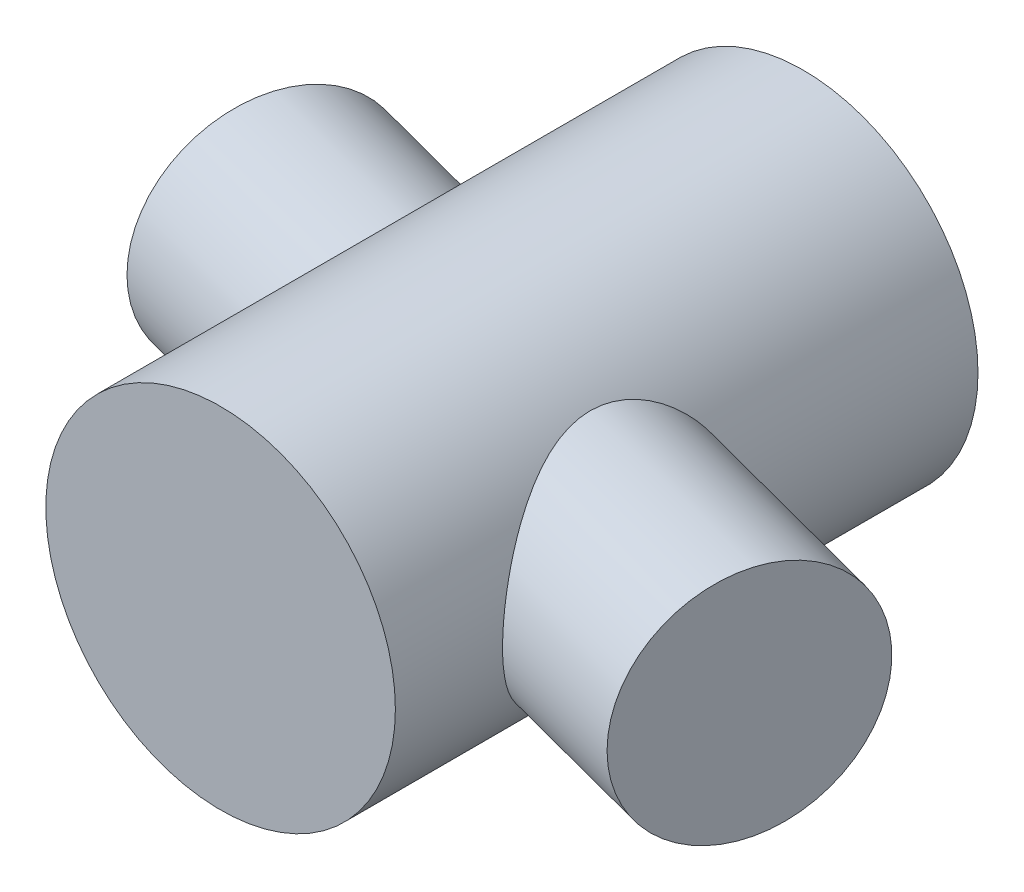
SolidWorks part; units mm, degrees
ref_plane "前视基准面" through (0, 0, 0) normal (0, 0, 1) x (1, 0, 0)
ref_plane "上视基准面" through (0, 0, 0) normal (0, 1, 0) x (1, 0, 0)
ref_plane "右视基准面" through (0, 0, 0) normal (1, 0, 0) x (0, 0, -1)
sketch "草图1" plane through (0, 0, 0) normal (0, 0, 1) x (1, 0, 0)
  circle A0 centre (0, 0) radius 15
  dimension "D1" = 30
extrude "拉伸1" add sketch "草图1" along normal blind 50
sketch "草图2" plane through (0, 0, 0) normal (0, 1, 0) x (1, 0, 0)
  line L0 (0, -69.1506) -> (-1.5864, 17.1315) construction
  line L1 (28.4848, -34.0174) -> (-29.2934, -18.7681) construction
  line L2 (27.1812, -44.0158) -> (-28.7906, -29.2432)
  line L3 (-28.7906, -29.2432) -> (-26.2387, -19.5743)
  line L4 (27.1812, -44.0158) -> (29.7331, -34.3469)
  line L5 (-26.2387, -19.5743) -> (29.7331, -34.3469)
  dimension "D1" = 10
revolve "旋转1" add sketch "草图2" angle 360 about L5
